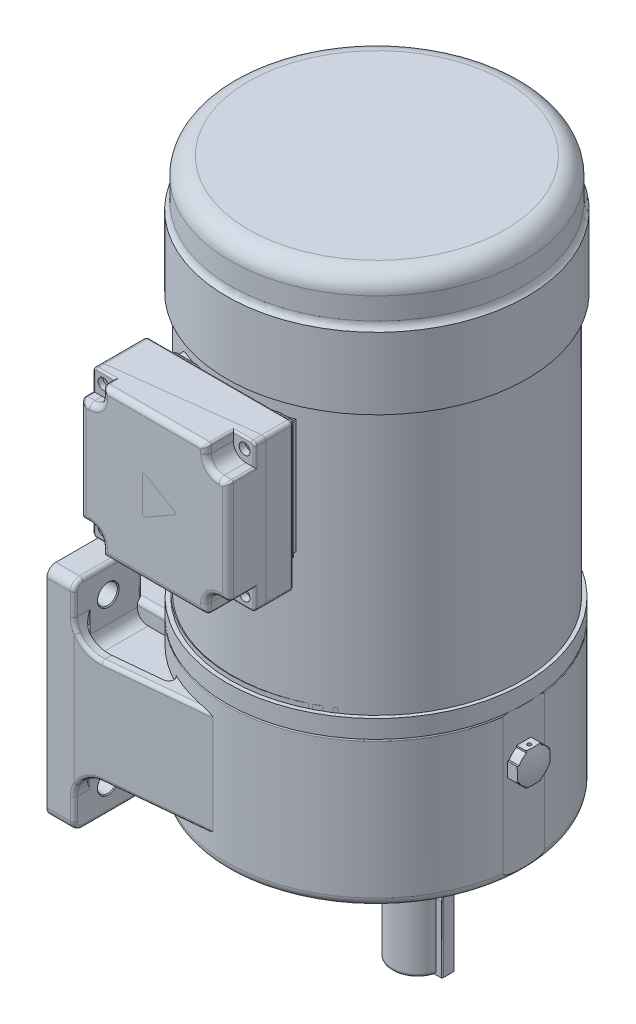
SolidWorks part; units mm, degrees
ref_plane "前视基准面" through (0, 0, 0) normal (0, 0, 1) x (1, 0, 0)
ref_plane "上视基准面" through (0, 0, 0) normal (0, 1, 0) x (1, 0, 0)
ref_plane "右视基准面" through (0, 0, 0) normal (1, 0, 0) x (0, 0, -1)
imported_body "接线盒座-1-surface1"
imported_body "接线盒座-1-surface2"
imported_body "接线盒座-1-surface3"
imported_body "接线盒座-1-surface4"
imported_body "接线盒座-1-surface5"
imported_body "接线盒座-1-surface6"
imported_body "接线盒座-1-surface7"
imported_body "接线盒盖-1-surface1"
imported_body "接线盒盖-1-surface2"
imported_body "接线盒盖-1-surface3"
imported_body "卧式箱体装配体-1/A版修模 28箱体-1-surface1"
imported_body "卧式箱体装配体-1/A版修模 28箱体-1-surface2"
imported_body "卧式箱体装配体-1/A版修模 28箱体-1-surface3"
imported_body "卧式箱体装配体-1/A版修模 28箱体-1-surface4"
imported_body "卧式箱体装配体-1/A版修模 28箱体-1-surface5"
imported_body "卧式箱体装配体-1/A版修模 28箱体-1-surface6"
imported_body "卧式箱体装配体-1/A版修模 28箱体-1-surface7"
imported_body "卧式箱体装配体-1/A版修模 28箱体-1-surface8"
imported_body "卧式箱体装配体-1/16.04.20 28箱盖配B版电机1500-1-surface1"
imported_body "卧式箱体装配体-1/16.04.20 28箱盖配B版电机1500-1-surface2"
imported_body "卧式箱体装配体-1/16.04.20 28箱盖配B版电机1500-1-surface3"
imported_body "卧式箱体装配体-1/16.04.20 28箱盖配B版电机1500-1-surface4"
imported_body "卧式箱体装配体-1/GB／T13871．1-2007唇形密封圈B型B15 30X45X7-1-surface1"
imported_body "卧式箱体装配体-1/透气塞-1-surface1"
imported_body "卧式箱体装配体-1/7X40-1-surface1"
sketch "草图1" plane through (0, -151.9871, 0) normal (0, 1, 0) x (1, 0, 0)
  circle A0 centre (45.8294, -4.7652) radius 80
  circle A1 centre (68.3294, -4.7652) radius 22.5 construction
  circle A2 centre (68.3294, -4.7652) radius 22.5 construction
extrude "凸台-拉伸1" add sketch "草图1" along normal blind 146
sketch "草图2" plane through (0, -5.9871, 0) normal (0, 1, 0) x (1, 0, 0)
  circle A0 centre (45.8294, -4.7652) radius 83
extrude "凸台-拉伸2" add sketch "草图2" along normal blind 39.5
sketch "草图3" plane through (0, 33.5129, 0) normal (0, 1, 0) x (1, 0, 0)
  circle A0 centre (45.8294, -4.7652) radius 81
extrude "凸台-拉伸3" add sketch "草图3" along normal blind 26
fillet "圆角1" radius 10 1 edges at (-35.1706, 59.5129, 4.7652)
fillet "圆角2" radius 5 1 edges at (-35.1706, 33.5129, 4.7652)
